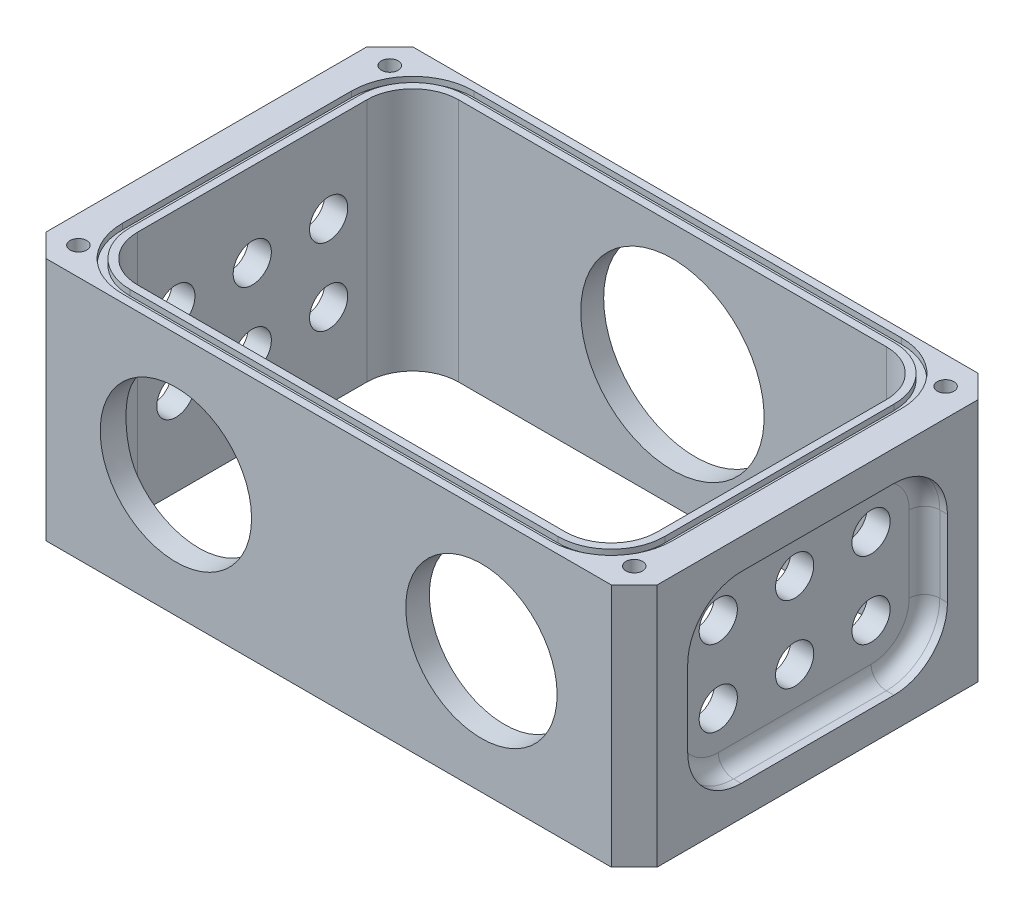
SolidWorks part; units mm, degrees
ref_plane "Front Plane" through (0, 0, 0) normal (0, 0, 1) x (1, 0, 0)
ref_plane "Top Plane" through (0, 0, 0) normal (0, 1, 0) x (1, 0, 0)
ref_plane "Right Plane" through (0, 0, 0) normal (1, 0, 0) x (0, 0, -1)
sketch "Sketch1" plane through (0, 0, 0) normal (0, 1, 0) x (1, 0, 0)
  line L1 (-63.5, -38.1) -> (63.5, -38.1)
  line L2 (-63.5, -38.1) -> (-63.5, 38.1)
  line L3 (-63.5, 38.1) -> (63.5, 38.1)
  line L4 (63.5, -38.1) -> (63.5, 38.1)
  line L5 (-63.5, -38.1) -> (63.5, 38.1) construction
  line L6 (-63.5, 38.1) -> (63.5, -38.1) construction
  point P0 (0, 0)
  dimension "D1" = 76.2
  dimension "D2" = 127
extrude "Boss-Extrude1" add sketch "Sketch1" along normal mid plane 50.8
sketch "Sketch3" plane through (0, 25.4, 0) normal (0, 1, 0) x (1, 0, 0)
  line L0 (63.5, 38.1) -> (-63.5, 38.1) construction
  line L1 (-63.5, -38.1) -> (63.5, -38.1) construction
  line L2 (63.5, -38.1) -> (63.5, 38.1) construction
  line L3 (-63.5, 38.1) -> (-63.5, -38.1) construction
  line L12 (53.975, -23.8125) -> (53.975, 23.8125)
  line L13 (44.45, 33.3375) -> (-44.45, 33.3375)
  line L14 (-53.975, 23.8125) -> (-53.975, -23.8125)
  line L15 (-44.45, -33.3375) -> (44.45, -33.3375)
  arc A0 (53.975, 23.8125) -> (44.45, 33.3375) centre (44.45, 23.8125) ccw
  arc A1 (53.975, -23.8125) -> (44.45, -33.3375) centre (44.45, -23.8125) cw
  arc A2 (-53.975, -23.8125) -> (-44.45, -33.3375) centre (-44.45, -23.8125) ccw
  arc A3 (-44.45, 33.3375) -> (-53.975, 23.8125) centre (-44.45, 23.8125) ccw
  dimension "D2" = 9.525
  dimension "D1" = 4.7625
  dimension "D3" = 4.7625
  dimension "D4" = 9.525
  dimension "D5" = 9.525
extrude "Cut-Extrude2" cut sketch "Sketch3" against normal offset from surface (38.1 mm away) 12.7
chamfer "Chamfer3" distance 4.7625 angle 45 4 edges at (63.5, 0, -38.1) (63.5, 0, 38.1) (-63.5, 0, -38.1) (-63.5, 0, 38.1)
sketch "Sketch9" plane through (-63.5, 0, 0) normal (-1, 0, 0) x (0, 0, 1)
  line L0 (-33.3375, 25.4) -> (33.3375, 25.4) construction
  line L1 (-15.875, -19.05) -> (15.875, -19.05)
  line L2 (-26.9875, -7.9375) -> (-26.9875, 7.9375)
  line L3 (-15.875, 19.05) -> (15.875, 19.05)
  line L4 (26.9875, -7.9375) -> (26.9875, 7.9375)
  line L5 (-26.9875, -19.05) -> (26.9875, 19.05) construction
  line L6 (-26.9875, 19.05) -> (26.9875, -19.05) construction
  line L7 (-33.3375, 25.4) -> (-33.3375, -25.4) construction
  arc A0 (15.875, 19.05) -> (26.9875, 7.9375) centre (15.875, 7.9375) cw
  arc A1 (15.875, -19.05) -> (26.9875, -7.9375) centre (15.875, -7.9375) ccw
  arc A2 (-15.875, -19.05) -> (-26.9875, -7.9375) centre (-15.875, -7.9375) cw
  arc A3 (-26.9875, 7.9375) -> (-15.875, 19.05) centre (-15.875, 7.9375) cw
  point P0 (0, 0)
  dimension "D3" = 11.1125
  dimension "D1" = 6.35
  dimension "D2" = 6.35
extrude "Cut-Extrude6" cut sketch "Sketch9" against normal offset from surface (4.7625 mm away) 4.7625
mirror "Mirror1" about plane through (0, 0, 0) normal (1, 0, 0) of "Cut-Extrude6"
sketch "Sketch11" plane through (0, 25.4, 0) normal (0, 1, 0) x (1, 0, 0)
  line L9 (44.45, 35.7188) -> (-44.45, 35.7188)
  line L10 (-56.3563, 23.8125) -> (-56.3563, -23.8125)
  line L11 (-44.45, -35.7188) -> (44.45, -35.7188)
  line L12 (56.3562, -23.8125) -> (56.3562, 23.8125)
  line L13 (44.45, 35.7188) -> (-44.45, 35.7188)
  line L14 (-56.3563, 23.8125) -> (-56.3563, -23.8125)
  line L15 (-44.45, -35.7188) -> (44.45, -35.7188)
  line L16 (56.3562, -23.8125) -> (56.3562, 23.8125)
  arc A8 (56.3562, 23.8125) -> (44.45, 35.7188) centre (44.45, 23.8125) ccw
  arc A9 (-44.45, 35.7188) -> (-56.3563, 23.8125) centre (-44.45, 23.8125) ccw
  arc A10 (-56.3563, -23.8125) -> (-44.45, -35.7188) centre (-44.45, -23.8125) ccw
  arc A11 (44.45, -35.7188) -> (56.3562, -23.8125) centre (44.45, -23.8125) ccw
  arc A12 (56.3562, 23.8125) -> (44.45, 35.7188) centre (44.45, 23.8125) ccw
  arc A13 (-44.45, 35.7188) -> (-56.3563, 23.8125) centre (-44.45, 23.8125) ccw
  arc A14 (-56.3563, -23.8125) -> (-44.45, -35.7188) centre (-44.45, -23.8125) ccw
  arc A15 (44.45, -35.7188) -> (56.3562, -23.8125) centre (44.45, -23.8125) ccw
  dimension "D1" = 2.3813
ref_plane "Plane1" through (0, 0, 23.8125) normal (0, 0, 1) x (1, 0, 0)
sketch "Sketch12" plane through (0, 0, 23.8125) normal (0, 0, 1) x (1, 0, 0)
  line L1 (-56.3563, 25.4) -> (-56.3563, 25.654) construction
  line L2 (-44.45, 25.4) -> (-56.3563, 25.4) construction
  line L3 (-58.7375, 25.4) -> (58.7375, 25.4) construction
  circle A0 centre (-56.3563, 25.654) radius 0.7937
  dimension "D1" = 1.5875
  dimension "D2" = 0.254
sweep "Cut-Sweep1" cut profiles "Sketch12" path "Sketch11"
mirror "Mirror2" about plane through (0, 0, 0) normal (0, 1, 0) of "Cut-Sweep1"
sketch "Sketch13" plane through (0, 25.4, 0) normal (0, 1, 0) x (1, 0, 0)
  line L0 (-61.1187, 35.7187) -> (-57.7512, 32.3512) construction
  line L1 (-58.7375, 38.1) -> (-63.5, 33.3375) construction
  circle A1 centre (-57.7512, 32.3512) radius 1.5875
  dimension "D1" = 4.7625
  dimension "D2" = 3.175
extrude "Cut-Extrude7" cut sketch "Sketch13" against normal through all both and the other way through all
mirror "Mirror3" about plane through (0, 0, 0) normal (1, 0, 0) of "Cut-Extrude7"
mirror "Mirror4" about plane through (0, 0, 0) normal (0, 0, 1) of "Mirror3", "Cut-Extrude7"
sketch "Sketch15" plane through (0, -12.7, 0) normal (0, 1, 0) x (1, 0, 0)
  line L4 (44.45, 33.3375) -> (-44.45, 33.3375)
  line L5 (-53.975, 23.8125) -> (-53.975, -23.8125)
  line L6 (-44.45, -33.3375) -> (44.45, -33.3375)
  line L7 (53.975, -23.8125) -> (53.975, 23.8125)
  line L8 (44.45, 33.3375) -> (-44.45, 33.3375)
  line L9 (-53.975, 23.8125) -> (-53.975, -23.8125)
  line L10 (-44.45, -33.3375) -> (44.45, -33.3375)
  line L11 (53.975, -23.8125) -> (53.975, 23.8125)
  arc A4 (53.975, 23.8125) -> (44.45, 33.3375) centre (44.45, 23.8125) ccw
  arc A5 (-44.45, 33.3375) -> (-53.975, 23.8125) centre (-44.45, 23.8125) ccw
  arc A6 (-53.975, -23.8125) -> (-44.45, -33.3375) centre (-44.45, -23.8125) ccw
  arc A7 (44.45, -33.3375) -> (53.975, -23.8125) centre (44.45, -23.8125) ccw
  arc A8 (53.975, 23.8125) -> (44.45, 33.3375) centre (44.45, 23.8125) ccw
  arc A9 (-44.45, 33.3375) -> (-53.975, 23.8125) centre (-44.45, 23.8125) ccw
  arc A10 (-53.975, -23.8125) -> (-44.45, -33.3375) centre (-44.45, -23.8125) ccw
  arc A11 (44.45, -33.3375) -> (53.975, -23.8125) centre (44.45, -23.8125) ccw
  dimension "D1" = 0
extrude "Cut-Extrude8" cut sketch "Sketch15" against normal through all both and the other way through all
sketch "Sketch16" plane through (0, 0, 38.1) normal (0, 0, 1) x (1, 0, 0)
  line L0 (0, 0) -> (-31.75, 0) construction
  line L1 (0, 25.4) -> (0, -25.4) construction
  line L4 (-58.7375, 25.4) -> (58.7375, 25.4) construction
  line L5 (-58.7375, -25.4) -> (58.7375, -25.4) construction
  circle A0 centre (-31.75, 0) radius 5.514
  circle A1 centre (31.75, 0) radius 5.514
  dimension "D1" = 31.75
hole_wizard "1 NPT Tapped Hole1" positions "3DSketch1" profile "Sketch17" size "1" standard "ANSI Inch"
sketch3d "3DSketch1"
  point P0 (-31.75, 0, 38.1)
  point P3 (31.75, 0, 38.1)
sketch "Sketch17" plane through (-31.75, 0, 38.1) normal (1, 0, 0) x (0, -1, 0)
  line L0 (0, 0) -> (0, 36.6469)
  line L1 (14.4907, 27.94) -> (0, 36.6469)
  line L2 (-14.4907, 27.94) -> (0, 36.6469) construction
  line L3 (14.4907, 27.94) -> (14.4907, 5.2064)
  line L4 (14.4907, 5.2064) -> (15.574, 5.2064)
  line L5 (15.574, 5.2064) -> (15.7299, 0)
  line L6 (-15.574, 5.2064) -> (-15.7299, 0) construction
  line L7 (15.7299, 0) -> (0, 0)
  line L8 (0, -6.35) -> (0, 107.95) construction
  line L11 (-14.4907, 5.2064) -> (-15.574, 5.2064) construction
  dimension "Tap Drill Dia." = 28.9814
  dimension "Tap Drill Depth" = 27.94
  dimension "Thread Dia." = 31.4598
  dimension "Thread Angle" = 3.43
  dimension "Thread Depth" = 5.2064
  dimension "Drill Angle" = 118
sketch "Sketch18" plane through (-58.7375, 0, 0) normal (-1, 0, 0) x (0, 0, 1)
  line L0 (-15.875, 7.9375) -> (15.875, 7.9375) construction
  line L1 (15.875, 7.9375) -> (15.875, -7.9375) construction
  line L2 (15.875, -7.9375) -> (-15.875, -7.9375) construction
  line L3 (-15.875, -7.9375) -> (-15.875, 7.9375) construction
  arc A0 (-26.9875, -7.9375) -> (-15.875, -19.05) centre (-15.875, -7.9375) ccw construction
  arc A1 (15.875, -19.05) -> (26.9875, -7.9375) centre (15.875, -7.9375) ccw construction
  arc A2 (26.9875, 7.9375) -> (15.875, 19.05) centre (15.875, 7.9375) ccw construction
  arc A4 (-26.9875, -7.9375) -> (-15.875, -19.05) centre (-15.875, -7.9375) ccw construction
  arc A5 (15.875, -19.05) -> (26.9875, -7.9375) centre (15.875, -7.9375) ccw construction
  arc A6 (26.9875, 7.9375) -> (15.875, 19.05) centre (15.875, 7.9375) ccw construction
  circle A8 centre (-15.875, 7.9375) radius 3.9687
  circle A9 centre (0, 7.9375) radius 3.9688
  circle A10 centre (15.875, 7.9375) radius 3.9687
  circle A11 centre (15.875, -7.9375) radius 3.9687
  circle A12 centre (0, -7.9375) radius 3.9688
  circle A13 centre (-15.875, -7.9375) radius 3.9687
  dimension "D1" = 7.9375
sketch "Sketch22" plane through (0, 0, -38.1) normal (0, 0, -1) x (-1, 0, 0)
  circle A0 centre (0, 0) radius 19.05
  dimension "D1" = 38.1
extrude "Cut-Extrude10" cut sketch "Sketch22" against normal blind 27.94
extrude "Cut-Extrude11" cut sketch "Sketch18" against normal blind 25.4
mirror "Mirror5" about plane through (0, 0, 0) normal (1, 0, 0) of "Cut-Extrude11"
sketch "Sketch24" plane through (0, 0, -38.1) normal (0, 0, -1) x (-1, 0, 0)
  line L1 (-25.4, -20.6375) -> (25.4, -20.6375) construction
  line L2 (-25.4, -20.6375) -> (-25.4, 20.6375) construction
  line L3 (-25.4, 20.6375) -> (25.4, 20.6375) construction
  line L4 (25.4, -20.6375) -> (25.4, 20.6375) construction
  line L5 (-25.4, -20.6375) -> (25.4, 20.6375) construction
  line L6 (-25.4, 20.6375) -> (25.4, -20.6375) construction
  circle A0 centre (-25.4, 20.6375) radius 3.1417
  circle A1 centre (25.4, 20.6375) radius 3.1417
  circle A2 centre (25.4, -20.6375) radius 3.1417
  circle A3 centre (-25.4, -20.6375) radius 3.1417
  point P0 (0, 0)
  dimension "D1" = 50.8
  dimension "D2" = 41.275
hole_wizard "Tap Drill for #8-32 Tap1" positions "3DSketch2" profile "Sketch25" hole size "#8-32" standard "ANSI Inch"
sketch3d "3DSketch2"
  point P0 (25.4, 20.6375, -38.1)
  point P3 (-25.4, 20.6375, -38.1)
  point P6 (-25.4, -20.6375, -38.1)
  point P9 (25.4, -20.6375, -38.1)
sketch "Sketch25" plane through (25.4, 20.6375, -38.1) normal (1, 0, 0) x (0, 1, 0)
  line L0 (0, 0) -> (0, 3.81)
  line L1 (0, 3.81) -> (1.7272, 2.7722)
  line L2 (1.7272, 2.7722) -> (1.7272, 0)
  line L5 (1.7272, 0) -> (0, 0)
  line L10 (0, 3.81) -> (-1.7272, 2.7722) construction
  line L11 (0, -6.35) -> (0, 107.95) construction
  dimension "Hole Dia." = 3.4544
  dimension "Hole Depth" = 3.81
  dimension "Drill Angle" = 118
sketch "Sketch33" plane through (0, 25.4, 0) normal (0, 1, 0) x (1, 0, 0)
  circle A0 centre (57.7512, 32.3512) radius 1.5875 construction
  circle A1 centre (57.7512, -32.3512) radius 1.5875 construction
  circle A2 centre (-57.7512, -32.3512) radius 1.5875 construction
  circle A3 centre (-57.7512, 32.3512) radius 1.5875 construction
  circle A4 centre (57.7512, 32.3512) radius 1.5875
  circle A5 centre (57.7512, -32.3512) radius 1.5875
  circle A6 centre (-57.7512, -32.3512) radius 1.5875
  circle A7 centre (-57.7512, 32.3512) radius 1.5875
extrude "Boss-Extrude2" add sketch "Sketch33" against normal up to surface (50.8 mm away) from offset 0
hole_wizard "Tap Drill for #8-32 Tap2" positions "3DSketch3" profile "Sketch34" hole size "#8-32" standard "ANSI Inch"
sketch3d "3DSketch3"
  point P0 (57.7512, 25.4, 32.3512)
  point P3 (57.7512, 25.4, -32.3512)
  point P6 (-57.7512, 25.4, -32.3512)
  point P9 (-57.7512, 25.4, 32.3512)
sketch "Sketch34" plane through (57.7512, 25.4, 32.3512) normal (1, 0, 0) x (0, 0, 1)
  line L0 (0, 0) -> (0, 12.7)
  line L1 (0, 12.7) -> (1.7272, 11.6622)
  line L2 (1.7272, 11.6622) -> (1.7272, 0)
  line L5 (1.7272, 0) -> (0, 0)
  line L10 (0, 12.7) -> (-1.7272, 11.6622) construction
  line L11 (0, -6.35) -> (0, 107.95) construction
  dimension "Hole Dia." = 3.4544
  dimension "Hole Depth" = 12.7
  dimension "Drill Angle" = 118
mirror "Mirror6" about plane through (0, 0, 0) normal (0, 1, 0) of "Tap Drill for #8-32 Tap2"
sketch "Sketch35" plane through (0, 0, 0) normal (0, 1, 0) x (1, 0, 0)
  line L0 (0, 38.1) -> (0, 43.9405) construction
  line L2 (0, 38.1) -> (-22.0853, 38.1) construction
  line L3 (-22.0853, 38.1) -> (-22.9743, 36.9094) construction
  line L4 (-23.8633, 38.1) -> (-23.8633, 36.9094)
  line L5 (-22.9743, 36.9094) -> (-23.8633, 38.1) construction
  line L6 (-23.8633, 38.1) -> (-22.0853, 38.1)
  line L7 (-23.8633, 38.1) -> (-22.0853, 38.1)
  line L8 (-23.8633, 36.9094) -> (-22.0853, 36.9094)
  line L9 (-22.0853, 36.9094) -> (-22.0853, 38.1)
  line L10 (58.7375, 38.1) -> (-58.7375, 38.1) construction
  dimension "D1" = 23.8633
  dimension "D2" = 22.0853
  dimension "D3" = 1.1906
revolve "Cut-Revolve1" cut sketch "Sketch35" angle 360 about L0
sketch "Sketch36" plane through (0, 25.4, 0) normal (0, 1, 0) x (1, 0, 0)
  line L0 (-57.1083, 23.8125) -> (-57.1083, -23.8125) construction
  line L1 (-55.6042, -23.8125) -> (-55.6042, 23.8125) construction
  line L2 (-44.45, -36.4708) -> (44.45, -36.4708) construction
  line L3 (44.45, -34.9667) -> (-44.45, -34.9667) construction
  line L4 (57.1083, -23.8125) -> (57.1083, 23.8125) construction
  line L5 (55.6042, 23.8125) -> (55.6042, -23.8125) construction
  line L6 (44.45, 36.4708) -> (-44.45, 36.4708) construction
  line L7 (-44.45, 34.9667) -> (44.45, 34.9667) construction
  line L8 (-57.1083, 23.8125) -> (-57.1083, -23.8125)
  line L9 (-55.6042, -23.8125) -> (-55.6042, 23.8125)
  line L10 (-44.45, -36.4708) -> (44.45, -36.4708)
  line L11 (44.45, -34.9667) -> (-44.45, -34.9667)
  line L12 (57.1083, -23.8125) -> (57.1083, 23.8125)
  line L13 (55.6042, 23.8125) -> (55.6042, -23.8125)
  line L14 (44.45, 36.4708) -> (-44.45, 36.4708)
  line L15 (-44.45, 34.9667) -> (44.45, 34.9667)
  arc A0 (-55.6042, -23.8125) -> (-44.45, -34.9667) centre (-44.45, -23.8125) ccw construction
  arc A1 (-57.1083, -23.8125) -> (-44.45, -36.4708) centre (-44.45, -23.8125) ccw construction
  arc A2 (44.45, -34.9667) -> (55.6042, -23.8125) centre (44.45, -23.8125) ccw construction
  arc A3 (44.45, -36.4708) -> (57.1083, -23.8125) centre (44.45, -23.8125) ccw construction
  arc A4 (55.6042, 23.8125) -> (44.45, 34.9667) centre (44.45, 23.8125) ccw construction
  arc A5 (57.1083, 23.8125) -> (44.45, 36.4708) centre (44.45, 23.8125) ccw construction
  arc A6 (-44.45, 34.9667) -> (-55.6042, 23.8125) centre (-44.45, 23.8125) ccw construction
  arc A7 (-44.45, 36.4708) -> (-57.1083, 23.8125) centre (-44.45, 23.8125) ccw construction
  arc A8 (-55.6042, -23.8125) -> (-44.45, -34.9667) centre (-44.45, -23.8125) ccw
  arc A9 (-57.1083, -23.8125) -> (-44.45, -36.4708) centre (-44.45, -23.8125) ccw
  arc A10 (44.45, -34.9667) -> (55.6042, -23.8125) centre (44.45, -23.8125) ccw
  arc A11 (44.45, -36.4708) -> (57.1083, -23.8125) centre (44.45, -23.8125) ccw
  arc A12 (55.6042, 23.8125) -> (44.45, 34.9667) centre (44.45, 23.8125) ccw
  arc A13 (57.1083, 23.8125) -> (44.45, 36.4708) centre (44.45, 23.8125) ccw
  arc A14 (-44.45, 34.9667) -> (-55.6042, 23.8125) centre (-44.45, 23.8125) ccw
  arc A15 (-44.45, 36.4708) -> (-57.1083, 23.8125) centre (-44.45, 23.8125) ccw
extrude "Boss-Extrude3" add sketch "Sketch36" against normal blind 2.54
mirror "Mirror7" about plane through (0, 0, 0) normal (0, 1, 0) of "Boss-Extrude3"
fillet "Fillet1" radius 3.175 16 edges at (58.7375, 0, -26.9875) (58.7375, -15.7952, -23.7327) (58.7375, -19.05, 0) (58.7375, -15.7952, 23.7327) (58.7375, 0, 26.9875) (58.7375, 15.7952, 23.7327) (58.7375, 19.05, 0) (-58.7375, 19.05, 0) (-58.7375, 15.7952, -23.7327) (-58.7375, 0, -26.9875) (-58.7375, -15.7952, -23.7327) (-58.7375, -19.05, 0) (-58.7375, -15.7952, 23.7327) (-58.7375, 0, 26.9875) (58.7375, 15.7952, -23.7327) (-58.7375, 15.7952, 23.7327)
sketch "Sketch39" plane through (0, 25.4, 0) normal (0, 1, 0) x (1, 0, 0)
  line L16 (-57.15, 23.8125) -> (-57.15, -23.8125)
  line L17 (-44.45, -36.5125) -> (44.45, -36.5125)
  line L18 (57.15, -23.8125) -> (57.15, 23.8125)
  line L19 (44.45, 36.5125) -> (-44.45, 36.5125)
  line L20 (-56.3563, 23.8125) -> (-56.3563, -23.8125)
  line L21 (-44.45, -35.7188) -> (44.45, -35.7188)
  line L22 (56.3562, -23.8125) -> (56.3562, 23.8125)
  line L23 (44.45, 35.7188) -> (-44.45, 35.7188)
  line L24 (-56.3563, 23.8125) -> (-56.3563, -23.8125) construction
  line L25 (-44.45, -35.7188) -> (44.45, -35.7188) construction
  line L26 (56.3562, -23.8125) -> (56.3562, 23.8125) construction
  line L27 (44.45, 35.7188) -> (-44.45, 35.7188) construction
  line L28 (-55.5625, 23.8125) -> (-55.5625, -23.8125)
  line L29 (-44.45, -34.925) -> (44.45, -34.925)
  line L30 (55.5625, -23.8125) -> (55.5625, 23.8125)
  line L31 (44.45, 34.925) -> (-44.45, 34.925)
  arc A21 (-44.45, 36.5125) -> (-57.15, 23.8125) centre (-44.45, 23.8125) ccw
  arc A22 (-57.15, -23.8125) -> (-44.45, -36.5125) centre (-44.45, -23.8125) ccw
  arc A23 (44.45, -36.5125) -> (57.15, -23.8125) centre (44.45, -23.8125) ccw
  arc A24 (57.15, 23.8125) -> (44.45, 36.5125) centre (44.45, 23.8125) ccw
  arc A25 (-56.3563, -23.8125) -> (-44.45, -35.7188) centre (-44.45, -23.8125) ccw
  arc A26 (44.45, -35.7188) -> (56.3562, -23.8125) centre (44.45, -23.8125) ccw
  arc A27 (56.3562, 23.8125) -> (44.45, 35.7188) centre (44.45, 23.8125) ccw
  arc A28 (-44.45, 35.7188) -> (-56.3563, 23.8125) centre (-44.45, 23.8125) ccw
  arc A29 (-56.3563, -23.8125) -> (-44.45, -35.7188) centre (-44.45, -23.8125) ccw construction
  arc A30 (44.45, -35.7188) -> (56.3562, -23.8125) centre (44.45, -23.8125) ccw construction
  arc A31 (56.3562, 23.8125) -> (44.45, 35.7188) centre (44.45, 23.8125) ccw construction
  arc A32 (-44.45, 35.7188) -> (-56.3563, 23.8125) centre (-44.45, 23.8125) ccw construction
  arc A33 (-44.45, 34.925) -> (-55.5625, 23.8125) centre (-44.45, 23.8125) ccw
  arc A34 (-55.5625, -23.8125) -> (-44.45, -34.925) centre (-44.45, -23.8125) ccw
  arc A35 (44.45, -34.925) -> (55.5625, -23.8125) centre (44.45, -23.8125) ccw
  arc A36 (55.5625, 23.8125) -> (44.45, 34.925) centre (44.45, 23.8125) ccw
  dimension "D1" = 2.3813
  dimension "D2" = 0.7937
  dimension "D3" = 0.7937
extrude "Cut-Extrude13" cut sketch "Sketch39" against normal blind 1.1906
mirror "Mirror10" about plane through (0, 0, 0) normal (0, 1, 0) of "Cut-Extrude13"
